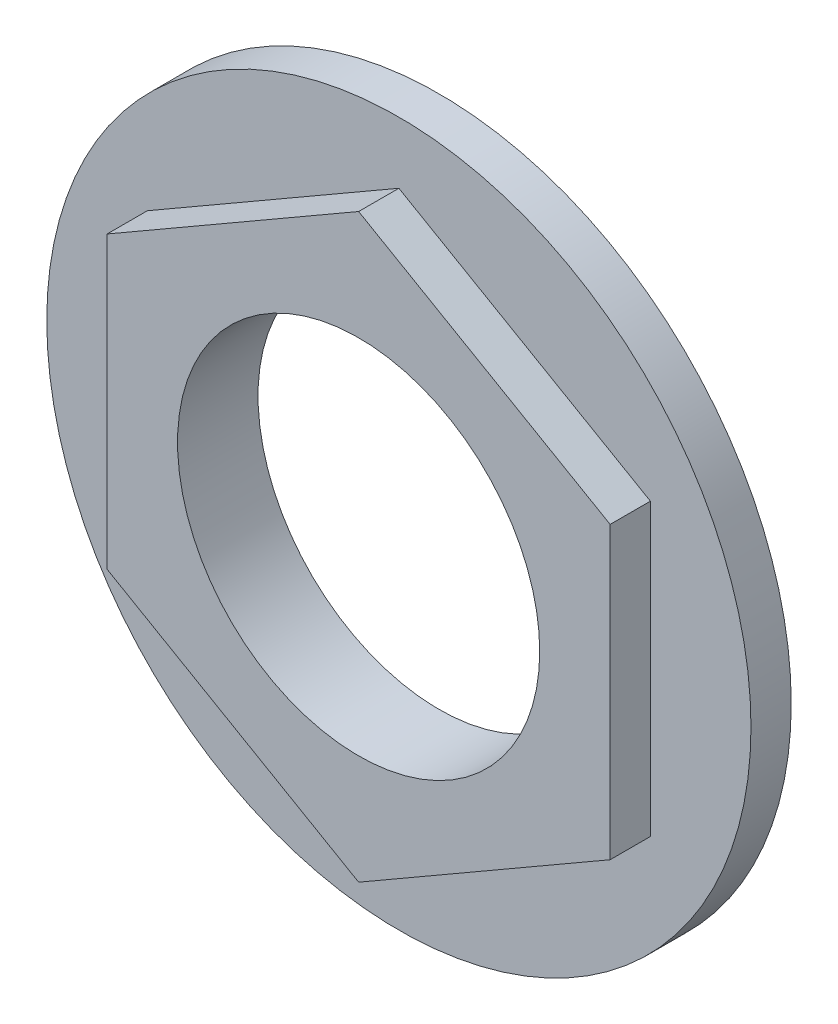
SolidWorks part; units mm, degrees
ref_plane "Front Plane" through (0, 0, 0) normal (0, 0, 1) x (1, 0, 0)
ref_plane "Top Plane" through (0, 0, 0) normal (0, 1, 0) x (1, 0, 0)
ref_plane "Right Plane" through (0, 0, 0) normal (1, 0, 0) x (0, 0, -1)
sketch "Sketch1" plane through (0, 0, 0) normal (0, 0, 1) x (1, 0, 0)
  circle A0 centre (0, 0) radius 8.75
  dimension "D1" = 17.5
extrude "Boss-Extrude1" add sketch "Sketch1" along normal blind 1
sketch "Sketch2" plane through (0, 0, 1) normal (0, 0, 1) x (1, 0, 0)
  line L1 (0, 7.2169) -> (-6.25, 3.6084)
  line L2 (-6.25, 3.6084) -> (-6.25, -3.6084)
  line L3 (-6.25, -3.6084) -> (0, -7.2169)
  line L4 (0, -7.2169) -> (6.25, -3.6084)
  line L5 (6.25, -3.6084) -> (6.25, 3.6084)
  line L6 (6.25, 3.6084) -> (0, 7.2169)
  circle A0 centre (0, 0) radius 6.25 construction
  dimension "D1" = 12.5
extrude "Boss-Extrude2" add sketch "Sketch2" along normal blind 1
sketch "Sketch3" plane through (0, 0, 2) normal (0, 0, 1) x (1, 0, 0)
  circle A0 centre (0, 0) radius 4.5
  dimension "D1" = 9
extrude "Cut-Extrude1" cut sketch "Sketch3" against normal up to next
